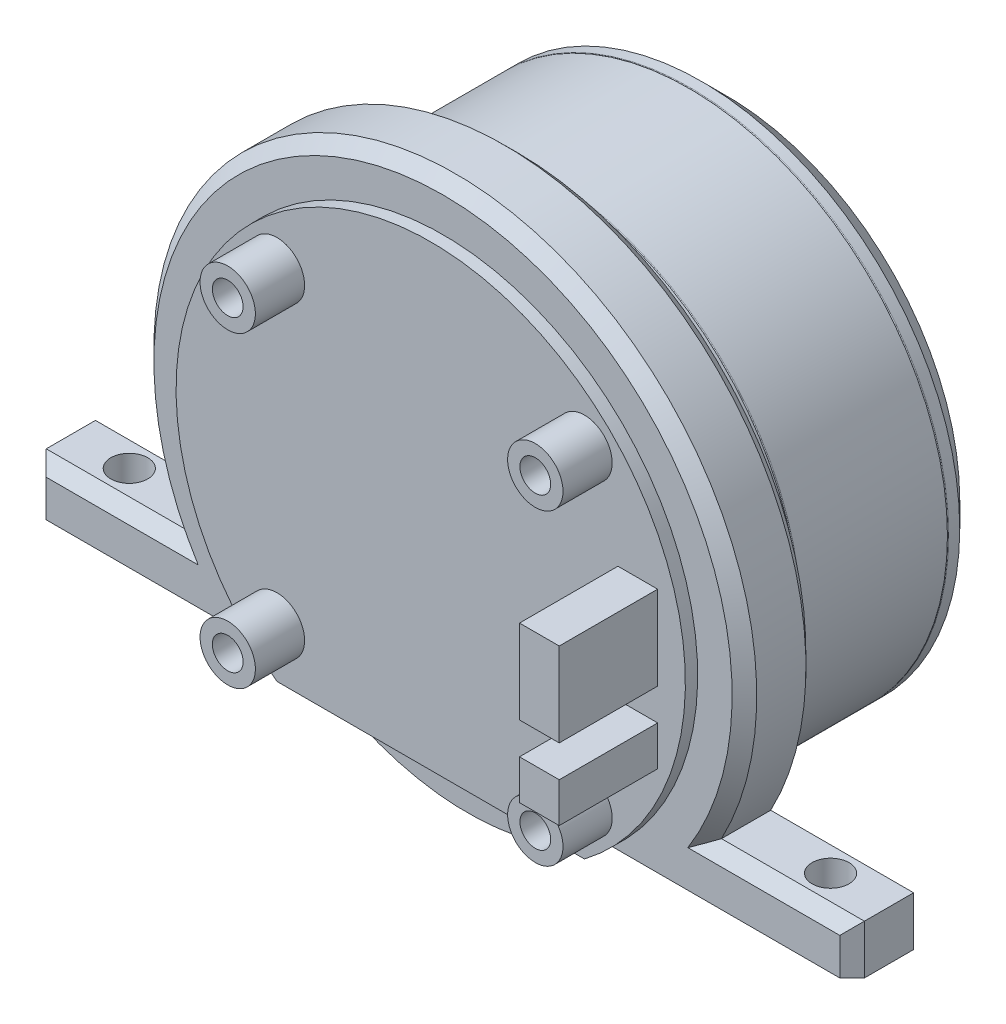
SolidWorks part; units mm, degrees
ref_plane "Front Plane" through (0, 0, 0) normal (0, 0, 1) x (1, 0, 0)
ref_plane "Top Plane" through (0, 0, 0) normal (0, 1, 0) x (1, 0, 0)
ref_plane "Right Plane" through (0, 0, 0) normal (1, 0, 0) x (0, 0, -1)
sketch "Sketch1" plane through (0, 0, 0) normal (0, 0, 1) x (1, 0, 0)
  circle A0 centre (0, 0) radius 21
  dimension "D1" = 42
extrude "Boss-Extrude1" add sketch "Sketch1" along normal blind 3
chamfer "Chamfer1" distance 2 angle 45 1 edges at (21, 0, 0)
fillet "Fillet1" radius 0.1 1 edges at (21, 0, 3)
sketch "Sketch2" plane through (0, 0, 3) normal (0, 0, 1) x (1, 0, 0)
  circle A0 centre (0, 0) radius 21 construction
  circle A1 centre (0, 0) radius 21
extrude "Boss-Extrude2" add sketch "Sketch2" along normal blind 12
fillet "Fillet2" radius 0.1 1 edges at (21, 0, 15)
sketch "Sketch3" plane through (0, 0, 15) normal (0, 0, 1) x (1, 0, 0)
  circle A0 centre (0, 0) radius 21 construction
  circle A1 centre (0, 0) radius 21
extrude "Boss-Extrude3" add sketch "Sketch3" along normal blind 6
sketch "Sketch4" plane through (0, 0, 0) normal (0, 0, -1) x (-1, 0, 0)
  line L0 (-10, 0) -> (0, 0) construction
  circle A0 centre (0, 0) radius 3
  circle A1 centre (-10, 0) radius 1.5
  circle A2 centre (0, 0) radius 3
  circle A3 centre (0, 10) radius 1.5
  circle A4 centre (0, 0) radius 3
  circle A5 centre (10, 0) radius 1.5
  circle A6 centre (0, 0) radius 3
  circle A7 centre (0, -10) radius 1.5
  point P17 (0, 0)
  dimension "D1" = 6
  dimension "D2" = 3
  dimension "D3" = 10
  dimension "D4" = 4
extrude "Cut-Extrude1" cut sketch "Sketch4" against normal blind 6
ref_plane "Plane1" through (0, 0, 17) normal (0, 0, 1) x (1, 0, 0)
sketch "Sketch5" plane through (0, 0, 17) normal (0, 0, 1) x (1, 0, 0)
  line L0 (21.6333, -11.5) -> (33.25, -11.5)
  line L1 (-33.25, -15.5) -> (33.25, -15.5)
  line L2 (-33.25, -15.5) -> (-33.25, -11.5)
  line L3 (-33.25, -11.5) -> (-21.6333, -11.5)
  line L4 (33.25, -15.5) -> (33.25, -11.5)
  line L5 (0, 0) -> (0, -15.5) construction
  arc A0 (21.6333, -11.5) -> (-21.6333, -11.5) centre (0, 0) ccw
  dimension "D1" = 49
  dimension "D2" = 66.5
  dimension "D3" = 4
  dimension "D4" = 15.5
extrude "Boss-Extrude4" add sketch "Sketch5" along normal blind 6
chamfer "Chamfer2" distance 1 angle 45 10 edges at (0, 24.5, 17) (0, 24.5, 23) (-33.25, -13.5, 17) (-27.4417, -11.5, 17) (33.25, -13.5, 17) (27.4417, -11.5, 17) (-33.25, -13.5, 23) (-27.4417, -11.5, 23) (33.25, -13.5, 23) (27.4417, -11.5, 23)
sketch "Sketch6" plane through (0, -11.5, 0) normal (0, 1, 0) x (1, 0, 0)
  line L0 (-28.5, -20) -> (28.5, -20) construction
  line L1 (0, -20) -> (0, 0) construction
  line L2 (19, 0) -> (-19, 0) construction
  line L3 (-23.5, -23) -> (23.5, -23) construction
  circle A0 centre (-28.5, -20) radius 1.5
  circle A1 centre (28.5, -20) radius 1.5
  dimension "D3" = 3
  dimension "D1" = 3
  dimension "D2" = 57
extrude "Cut-Extrude2" cut sketch "Sketch6" against normal through all and the other way through all
sketch "Sketch7" plane through (0, 0, 23) normal (0, 0, 1) x (1, 0, 0)
  line L0 (12.4996, -16.5) -> (-12.4996, -16.5)
  line L1 (-32.25, -15.5) -> (32.25, -15.5) construction
  arc A0 (12.4996, -16.5) -> (-12.4996, -16.5) centre (0, 0) ccw
  dimension "D2" = 20.7
  dimension "D1" = 1
extrude "Boss-Extrude5" add sketch "Sketch7" along normal blind 1
sketch "Sketch8" plane through (0, 0, 24) normal (0, 0, 1) x (1, 0, 0)
  line L1 (-12.5, 12.5) -> (12.5, 12.5) construction
  line L2 (-12.5, 12.5) -> (-12.5, -12.5) construction
  line L3 (-12.5, -12.5) -> (12.5, -12.5) construction
  line L4 (12.5, 12.5) -> (12.5, -12.5) construction
  line L5 (-12.5, 12.5) -> (12.5, -12.5) construction
  line L6 (-12.5, -12.5) -> (12.5, 12.5) construction
  circle A0 centre (-12.5, 12.5) radius 2.25
  circle A1 centre (12.5, 12.5) radius 2.25
  circle A2 centre (12.5, -12.5) radius 2.25
  circle A3 centre (-12.5, -12.5) radius 2.25
  point P0 (0, 0)
  dimension "D2" = 4.5
  dimension "D1" = 25
extrude "Boss-Extrude6" add sketch "Sketch8" along normal blind 4
sketch "Sketch9" plane through (0, 0, 28) normal (0, 0, 1) x (1, 0, 0)
  circle A2 centre (12.5, 12.5) radius 1.25
  circle A3 centre (12.5, 12.5) radius 1.25
  circle A4 centre (12.5, -12.5) radius 1.25
  circle A5 centre (12.5, -12.5) radius 1.25
  circle A8 centre (-12.5, 12.5) radius 1.25
  circle A9 centre (-12.5, 12.5) radius 1.25
  circle A11 centre (-12.5, -12.5) radius 1.25
  circle A12 centre (-12.5, -12.5) radius 1.25
  dimension "D1" = 1
  dimension "D2" = 1
  dimension "D3" = 1
  dimension "D4" = 1
extrude "Cut-Extrude3" cut sketch "Sketch9" against normal blind 4
sketch "Sketch10" plane through (0, 0, 24) normal (0, 0, 1) x (1, 0, 0)
  line L0 (15.2167, -1.355) -> (15.2167, -3.9466) construction
  line L1 (15.2167, 5.4678) -> (18.4459, 5.4678)
  line L2 (15.2167, 5.4678) -> (15.2167, -1.355)
  line L3 (15.2167, -1.355) -> (18.4459, -1.355)
  line L4 (18.4459, 5.4678) -> (18.4459, -1.355)
  line L5 (15.2167, -3.9466) -> (18.4459, -3.9466)
  line L6 (15.2167, -3.9466) -> (15.2167, -7.1758)
  line L7 (15.2167, -7.1758) -> (18.4459, -7.1758)
  line L8 (18.4459, -3.9466) -> (18.4459, -7.1758)
  line L9 (18.4459, -3.9466) -> (18.4459, -1.355) construction
  point P9 (14.7883, -1.5711)
  point P10 (12.5472, -1.6394)
extrude "Boss-Extrude7" add sketch "Sketch10" along normal blind 8
